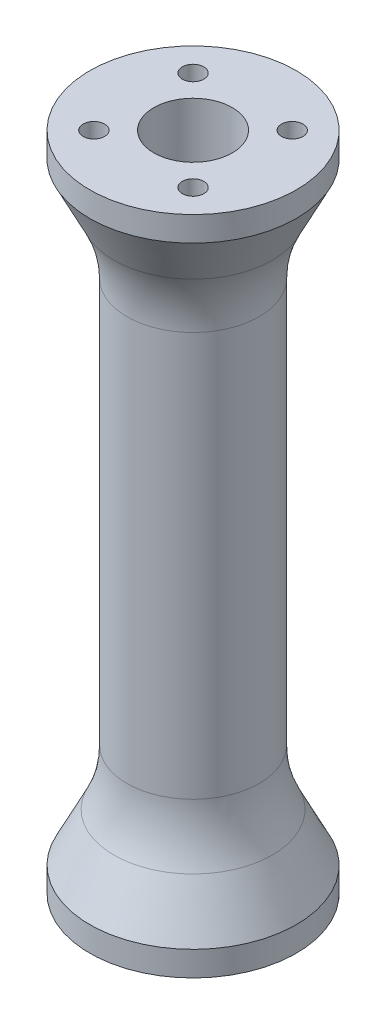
SolidWorks part; units mm, degrees
ref_plane "Front Plane" through (0, 0, 0) normal (0, 0, 1) x (1, 0, 0)
ref_plane "Top Plane" through (0, 0, 0) normal (0, 1, 0) x (1, 0, 0)
ref_plane "Right Plane" through (0, 0, 0) normal (1, 0, 0) x (0, 0, -1)
sketch "Sketch1" plane through (0, 0, 0) normal (0, 0, 1) x (1, 0, 0)
  line L0 (0, -40) -> (0, 40)
  line L1 (0, 40) -> (-12.5, 40)
  line L2 (-12.5, 40) -> (-12.5, 37)
  line L3 (-12.5, 37) -> (-8, 28)
  line L4 (-8, 28) -> (-8, -28)
  line L5 (-8, 0) -> (0, 0) construction
  line L6 (-12.5, -37) -> (-8, -28)
  line L7 (-12.5, -40) -> (-12.5, -37)
  line L8 (0, -40) -> (-12.5, -40)
  dimension "D1" = 12.5
  dimension "D2" = 3
  dimension "D3" = 8
  dimension "D4" = 80
  dimension "D5" = 12
revolve "Revolve1" add sketch "Sketch1" angle 360 about L0
sketch "Sketch2" plane through (0, 40, 0) normal (0, 1, 0) x (1, 0, 0)
  line L1 (6, -6) -> (-6, -6) construction
  line L2 (6, -6) -> (6, 6) construction
  line L3 (6, 6) -> (-6, 6) construction
  line L4 (-6, -6) -> (-6, 6) construction
  line L5 (6, -6) -> (-6, 6) construction
  line L6 (6, 6) -> (-6, -6) construction
  circle A0 centre (-6, 6) radius 1.3
  circle A1 centre (6, 6) radius 1.3
  circle A2 centre (-6, -6) radius 1.3
  circle A3 centre (6, -6) radius 1.3
  point P0 (0, 0)
  dimension "D1" = 12
  dimension "D2" = 2.6
extrude "Cut-Extrude1" cut sketch "Sketch2" against normal blind 7
mirror "Mirror1" about plane through (0, 0, 0) normal (0, 1, 0) of "Cut-Extrude1"
sketch "Sketch3" plane through (0, 0, 0) normal (1, 0, 0) x (0, 0, -1)
  line L0 (-7, 29.7) -> (0, 36.7)
  line L1 (8, 28) -> (-8, 28) construction
  line L2 (0, 36.7) -> (0, -36.7)
  line L3 (0, 0) -> (-7, 0) construction
  line L4 (-7, -29.7) -> (-7, 29.7)
  line L5 (-8, 28) -> (-8, -28) construction
  line L6 (-7, -29.7) -> (0, -36.7)
  line L7 (-4.7, 33) -> (-4.7, 32) construction
  line L8 (-4.7, 33) -> (-7.3, 33) construction
  dimension "D1" = 1
  dimension "D2" = 45
  dimension "D3" = 1
revolve "Cut-Revolve1" cut sketch "Sketch3" angle 360 about L2
sketch "Sketch4" plane through (0, 40, 0) normal (0, 1, 0) x (1, 0, 0)
  circle A3 centre (0, 0) radius 4.75
  dimension "D1" = 9.5
extrude "Cut-Extrude2" cut sketch "Sketch4" against normal through all
fillet "Fillet1" radius 15 2 edges at (0, 28, -8) (0, -28, -8)
fillet "Fillet2" radius 4 2 edges at (0, -29.7, 7) (0, 29.7, 7)
